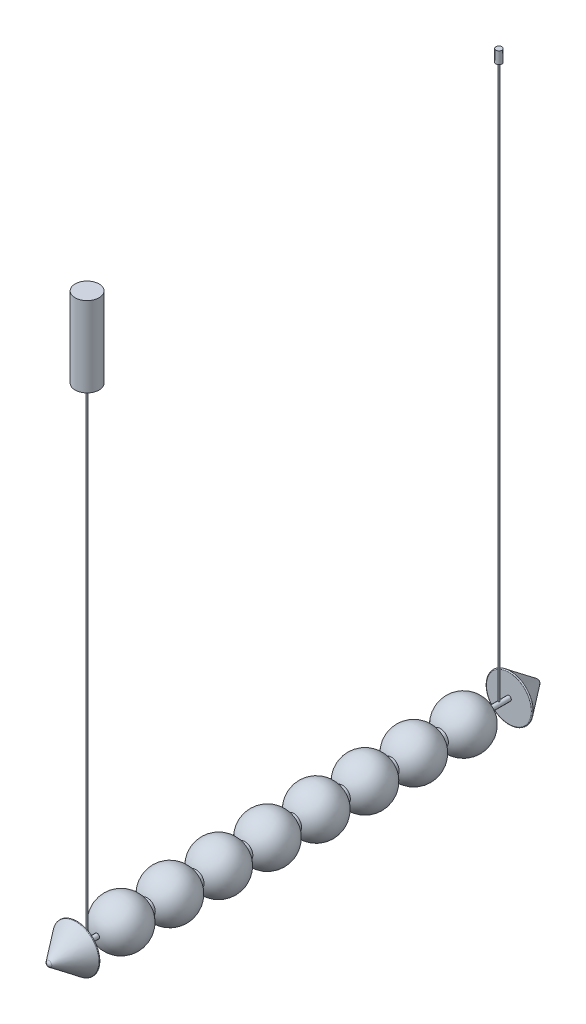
SolidWorks part; units mm, degrees
ref_plane "Alzado" through (0, 0, 0) normal (0, 0, 1) x (1, 0, 0)
ref_plane "Planta" through (0, 0, 0) normal (0, 1, 0) x (1, 0, 0)
ref_plane "Vista lateral" through (0, 0, 0) normal (1, 0, 0) x (0, 0, -1)
sketch "Croquis1" plane through (0, 0, 0) normal (0, 0, 1) x (1, 0, 0)
  circle A0 centre (0, 0) radius 6
  dimension "D1" = 12
extrude "Saliente-Extruir1" add sketch "Croquis1" against normal blind 50
sketch "Croquis2" plane through (0, 0, 0) normal (0, 1, 0) x (1, 0, 0)
  line L0 (0, 50) -> (0, 170) construction
  line L1 (6, 50) -> (-6, 50) construction
  line L2 (0, 50) -> (0, 170)
  arc A0 (0, 50) -> (0, 170) centre (0, 110) cw
  dimension "D1" = 120
revolve "Revolución1" add sketch "Croquis2" angle 360 about L0
sketch "Croquis3" plane through (0, 0, 0) normal (0, 1, 0) x (1, 0, 0)
  line L0 (0, 166.7058) -> (0, 176.7058) construction
  line L1 (0, 166.7058) -> (-20, 166.7058)
  line L2 (-20, 166.7058) -> (-20, 176.7058)
  line L3 (-20, 176.7058) -> (0, 176.7058)
  line L4 (0, 166.7058) -> (0, 176.7058)
  dimension "D1" = 10
  dimension "D2" = 20
revolve "Revolución2" add sketch "Croquis3" angle 360 about L0
pattern_linear "MatrizL1" count 7 spacing 122 along (0, 0, -1)
sketch "Croquis4" plane through (0, 0, 0) normal (0, 1, 0) x (1, 0, 0)
  line L0 (0, 906.1345) -> (0, 1026.1345) construction
  line L2 (0, 906.1345) -> (0, 1026.1345)
  arc A0 (0, 906.1345) -> (0, 1026.1345) centre (0, 966.1345) ccw
  dimension "D1" = 120
revolve "Revolución3" add sketch "Croquis4" angle 360 about L0
ref_plane "Plano1" through (0, 0, -1025) normal (0, 0, 1) x (1, 0, 0)
sketch "Croquis5" plane through (0, 0, -1025) normal (0, 0, 1) x (1, 0, 0)
  circle A0 centre (0, 0) radius 6
  dimension "D1" = 12
extrude "Saliente-Extruir2" add sketch "Croquis5" against normal blind 55 separate body
sketch "Croquis6" plane through (0, 0, 0) normal (0, 1, 0) x (1, 0, 0)
  line L0 (0, 0) -> (0, -80) construction
  line L1 (0, 0) -> (-60, 0)
  line L2 (-60, 0) -> (-7.141, -70.4787)
  line L3 (0, 0) -> (0, -74.3804)
  arc A0 (-7.141, -70.4787) -> (0, -74.3804) centre (0.7145, -64.5871) ccw
  dimension "D1" = 60
  dimension "D2" = 80
revolve "Revolución4" add sketch "Croquis6" angle 360 about L0
ref_plane "Plano2" through (0, 0, -540) normal (0, 0, -1) x (-1, 0, 0)
mirror "Simetría1" about plane through (0, 0, -540) normal (0, 0, -1)
sketch "Croquis7" plane through (0, 0, 0) normal (0, 1, 0) x (1, 0, 0)
  line L0 (0, 0) -> (0, 25) construction
  circle A0 centre (0, 25) radius 1.5
  dimension "D2" = 3
  dimension "D1" = 25
extrude "Saliente-Extruir3" add sketch "Croquis7" along normal blind 1200 separate body
fillet "Redondeo1" radius 2 1 edges at (-60, 0, 0)
fillet "Redondeo2" radius 2 1 edges at (-60, 0, -1080)
sketch "Croquis8" plane through (0, 0, 0) normal (0, 1, 0) x (1, 0, 0)
  line L0 (0, 1080) -> (0, 1055) construction
  line L1 (6, 1080) -> (-6, 1080) construction
  circle A0 centre (0, 1055) radius 1.5
  dimension "D2" = 3
  dimension "D1" = 25
extrude "Saliente-Extruir4" add sketch "Croquis8" along normal blind 1390 separate body
sketch "Croquis9" plane through (0, 1200, 0) normal (0, 1, 0) x (1, 0, 0)
  circle A0 centre (0, 25) radius 5
  dimension "D1" = 10
extrude "Saliente-Extruir5" add sketch "Croquis9" along normal blind 10 separate body
sketch "Croquis10" plane through (0, 1210, 0) normal (0, 1, 0) x (1, 0, 0)
  circle A0 centre (0, 25) radius 30
  dimension "D1" = 60
extrude "Saliente-Extruir6" add sketch "Croquis10" along normal blind 200 separate body
sketch "Croquis11" plane through (0, 1390, 0) normal (0, 1, 0) x (1, 0, 0)
  circle A0 centre (0, 1055) radius 7.5
  dimension "D1" = 15
extrude "Saliente-Extruir7" add sketch "Croquis11" along normal blind 30 separate body
